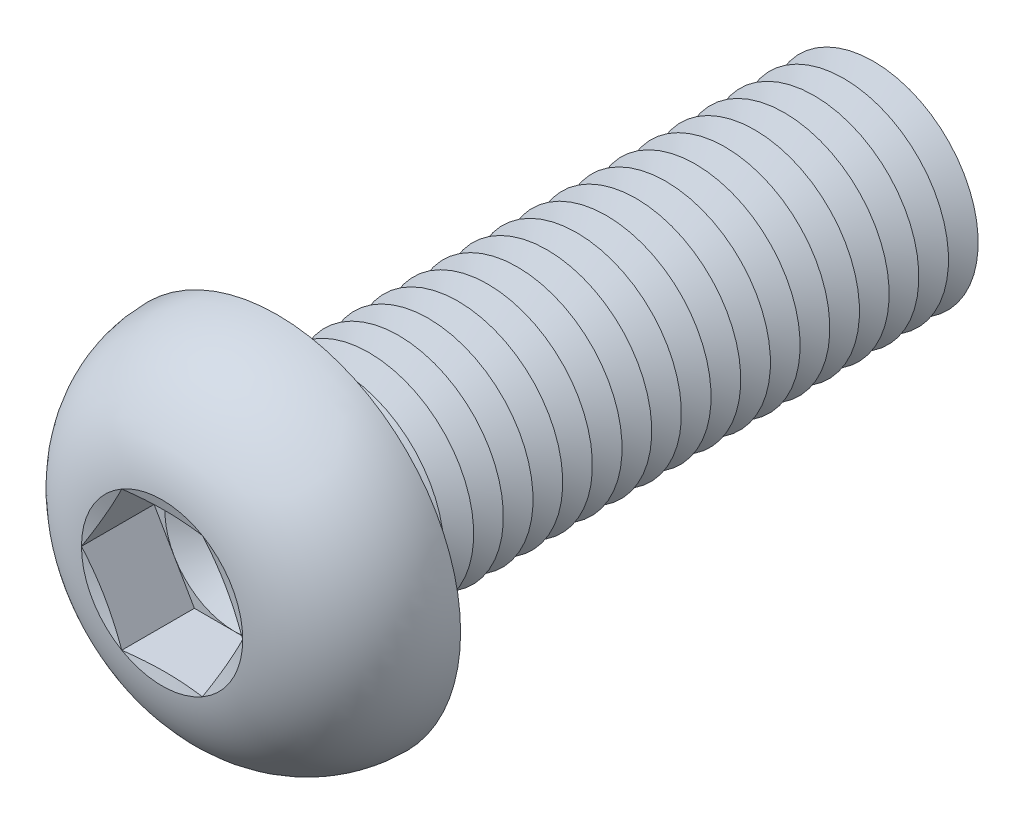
SolidWorks part; units mm, degrees
ref_plane "Front Plane" through (0, 0, 0) normal (0, 0, 1) x (1, 0, 0)
ref_plane "Top Plane" through (0, 0, 0) normal (0, 1, 0) x (1, 0, 0)
ref_plane "Right Plane" through (0, 0, 0) normal (1, 0, 0) x (0, 0, -1)
sketch "Sketch1" plane through (0, 0, 0) normal (1, 0, 0) x (0, 0, -1)
  line L0 (0, 6) -> (0, 10.5)
  line L3 (0, 6) -> (35, 6)
  line L4 (35, 6) -> (35, 0)
  line L5 (35, 0) -> (-6.6, 0) construction
  line L6 (-6.6, 0) -> (35, 0)
  line L7 (-6.6, 4.6188) -> (-6.6, 2.3094) construction
  line L8 (-6.6, 2.3094) -> (-6.6, 0)
  line L9 (-6.6, 4.6188) -> (-5.9812, 2.3094)
  line L10 (-5.9812, 2.3094) -> (-6.6, 2.3094)
  line L11 (35, 0) -> (22.7481, 0) construction
  line L12 (0, 10.5) -> (-6.6, 10.5) construction
  arc A1 (0, 10.5) -> (-6.6, 4.6188) centre (0, 3.8561) ccw
  point P8 (35, 3)
  dimension "D1" = 21
  dimension "D2" = 12
  dimension "D3" = 6.6
  dimension "D4" = 9.2376
  dimension "D5" = 35
  dimension "D6" = 15
revolve "Revolve1" add sketch "Sketch1" angle 360 about L5
fillet "Fillet1" radius 0.85 1 edges at (0, 6, 0)
sketch "Sketch2" plane through (0, 0, 0) normal (1, 0, 0) x (0, 0, -1)
  line L0 (34.15, 6) -> (35.85, 6)
  line L1 (35, 6) -> (0.85, 6) construction
  line L2 (35.85, 6) -> (35, 4.5278)
  line L3 (35, -6) -> (35, 6) construction
  line L4 (35, 4.5278) -> (34.15, 6)
  dimension "D1" = 1.7
revolve "Cut-Revolve1" cut sketch "Sketch2" angle 360 about axis through (0, 0, -35) along (0, 0, -1)
pattern_linear "LPattern1" count 20 spacing 1.7 along (0, 0, 1) of "Cut-Revolve1"
sketch "Sketch3" plane through (0, 0, 6.6) normal (0, 0, 1) x (1, 0, 0)
  line L7 (2.3094, 4) -> (-2.3094, 4)
  line L8 (-2.3094, 4) -> (-4.6188, 0)
  line L9 (-4.6188, 0) -> (-2.3094, -4)
  line L10 (-2.3094, -4) -> (2.3094, -4)
  line L11 (2.3094, -4) -> (4.6188, 0)
  line L12 (4.6188, 0) -> (2.3094, 4)
  circle A0 centre (0, 0) radius 4 construction
  circle A3 centre (0, 0) radius 4.6188 construction
extrude "Cut-Extrude1" cut sketch "Sketch3" against normal blind 4.16
sketch "Sketch4" plane through (0, 0, 2.44) normal (0, 0, 1) x (1, 0, 0)
  line L1 (2.3094, 4) -> (-2.3094, 4) construction
  circle A0 centre (0, 0) radius 4
extrude "Cut-Extrude2" cut sketch "Sketch4" against normal through all draft 60
